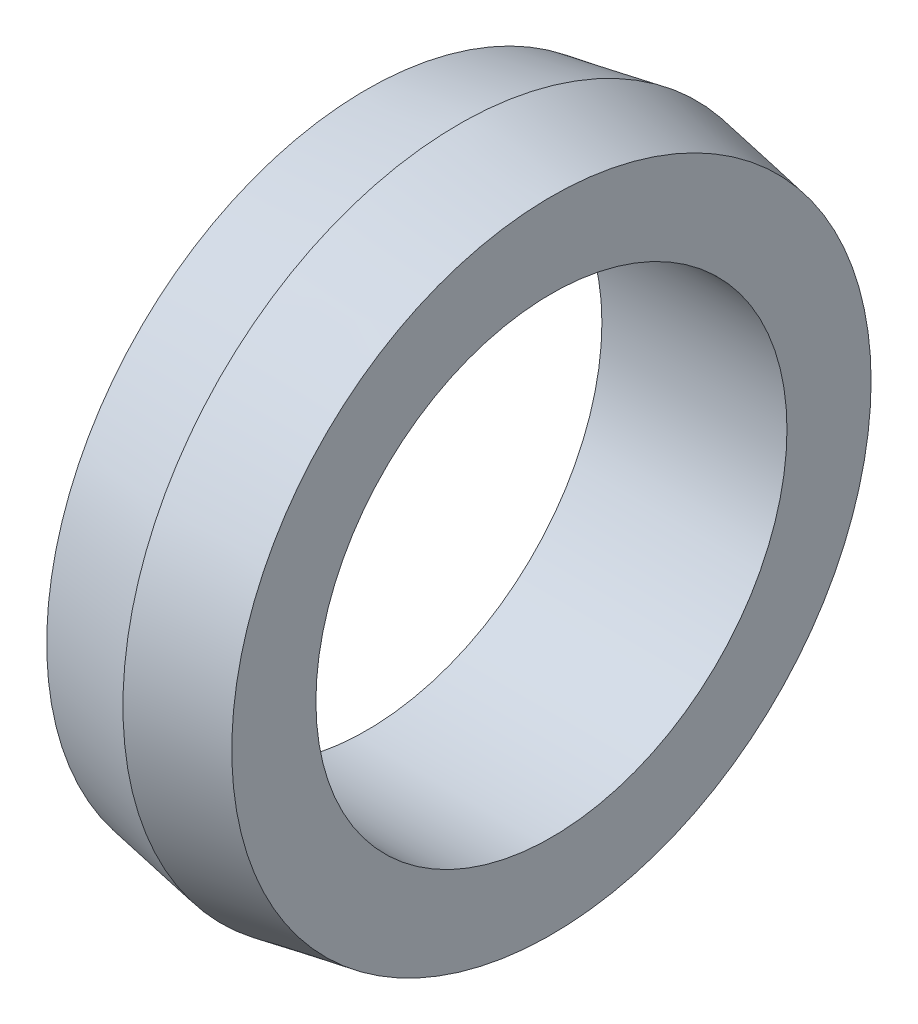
SolidWorks part; units mm, degrees
ref_plane "Front Plane" through (0, 0, 0) normal (0, 0, 1) x (1, 0, 0)
ref_plane "Top Plane" through (0, 0, 0) normal (0, 1, 0) x (1, 0, 0)
ref_plane "Right Plane" through (0, 0, 0) normal (1, 0, 0) x (0, 0, -1)
sketch "Sketch1" plane through (0, 0, 0) normal (0, 0, 1) x (1, 0, 0)
  line L0 (-16.5, 42) -> (16.5, 42)
  line L1 (16.5, 42) -> (16.5, 57)
  line L2 (16.5, 57) -> (0, 59.9094)
  line L3 (-16.5, 42) -> (-16.5, 57)
  line L4 (-16.5, 57) -> (0, 59.9094)
  line L5 (0, 0) -> (0, 59.9094) construction
  line L6 (0, 0) -> (-64.008, 0) construction
  line L8 (0, 59.9094) -> (-12.2184, 59.9094) construction
  dimension "D1" = 10
revolve "Revolve1" add sketch "Sketch1" angle 360 about L6
